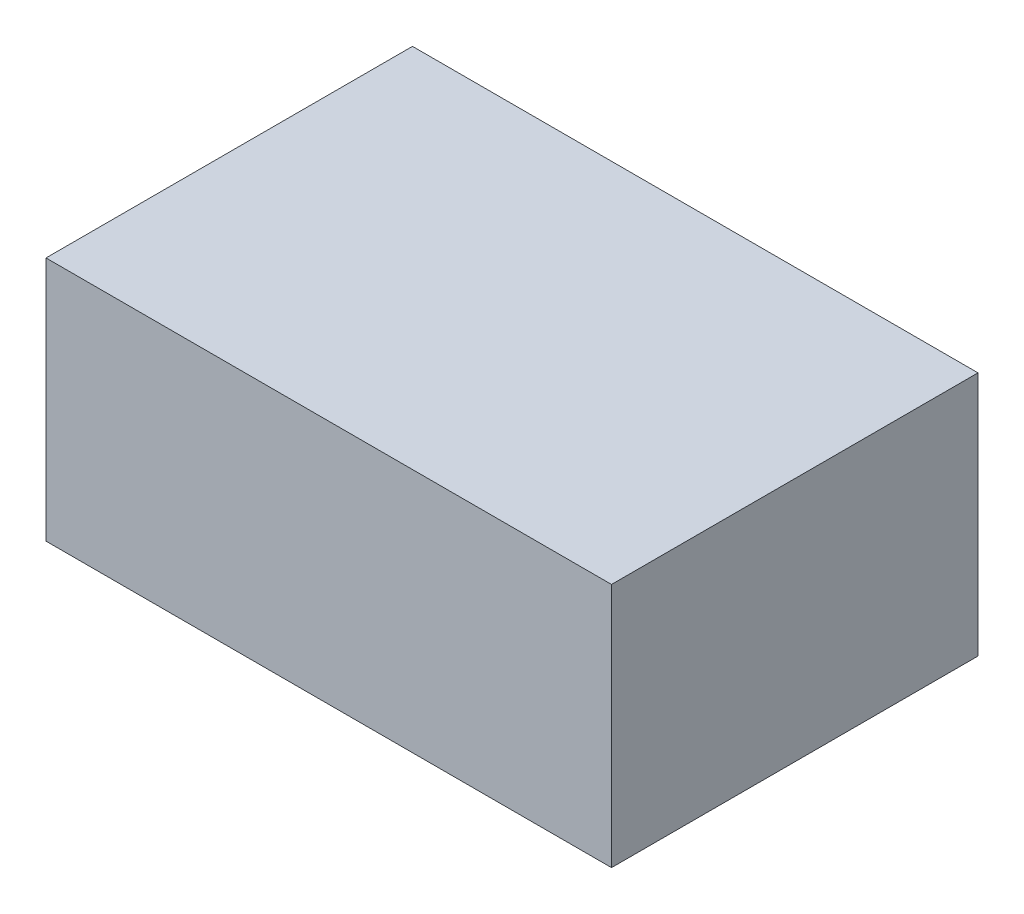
SolidWorks part; units mm, degrees
ref_plane "Front Plane" through (0, 0, 0) normal (0, 0, 1) x (1, 0, 0)
ref_plane "Top Plane" through (0, 0, 0) normal (0, 1, 0) x (1, 0, 0)
ref_plane "Right Plane" through (0, 0, 0) normal (1, 0, 0) x (0, 0, -1)
sketch "Sketch1" plane through (0, 0, 0) normal (0, 1, 0) x (1, 0, 0)
  line L0 (55.8774, -36.2109) -> (-55.8774, 36.2109) construction
  line L1 (-55.8774, 36.2109) -> (55.8774, 36.2109)
  line L2 (-55.8774, 36.2109) -> (-55.8774, -36.2109)
  line L3 (-55.8774, -36.2109) -> (55.8774, -36.2109)
  line L4 (55.8774, 36.2109) -> (55.8774, -36.2109)
extrude "Extrude1" add sketch "Sketch1" along normal blind 48.4691
sketch "Sketch2" plane through (0, 48.4691, 0) normal (0, 1, 0) x (-1, 0, 0)
  line L0 (0, 36.2109) -> (0, -36.2109) construction
  line L1 (55.8774, 36.2109) -> (-55.8774, 36.2109) construction
  line L2 (-55.8774, -36.2109) -> (55.8774, -36.2109) construction
  line L3 (0, -27.0017) -> (-34.4197, -27.0017)
  line L4 (-22.2541, 26.805) -> (0, 26.805)
  line L5 (0, 26.805) -> (0, -27.0017)
  spline S0 degree 3 poles (-34.4197, -27.0017) (-28.7723, -21.729) (-16.6023, -10.3667) (-39.3343, 9.6821) (-27.669, 21.3765) (-22.2541, 26.805) knots 0 0 0 0 0.316909 0.682916 1 1 1 1
